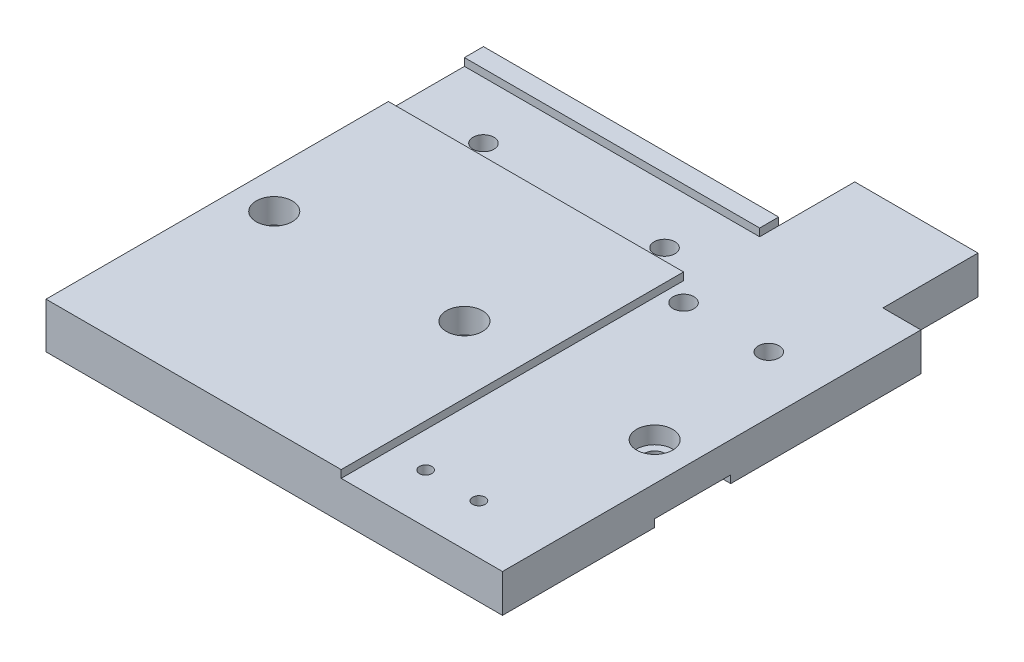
SolidWorks part; units mm, degrees
ref_plane "前视基准面" through (0, 0, 0) normal (0, 0, 1) x (1, 0, 0)
ref_plane "上视基准面" through (0, 0, 0) normal (0, 1, 0) x (1, 0, 0)
ref_plane "右视基准面" through (0, 0, 0) normal (1, 0, 0) x (0, 0, -1)
sketch "草图2" plane through (0, 0, 0) normal (0, 0, 1) x (1, 0, 0)
  line L0 (120, 0) -> (120, 10)
  line L1 (77.6, 10) -> (77.6, 12)
  line L2 (0, 0) -> (0, 12)
  line L3 (77.6, 10) -> (120, 10)
  line L4 (0, 0) -> (120, 0)
  line L5 (0, 12) -> (77.6, 12)
extrude "凸台-拉伸1" add sketch "草图2" along normal blind 135
sketch "草图3" plane through (0, 12, 0) normal (0, 1, 0) x (1, 0, 0)
  line L0 (0, -135) -> (120, -135)
  line L1 (77.6, 0) -> (110, 0)
  line L2 (120, -135) -> (120, -25)
  line L3 (0, -135) -> (0, -20)
  line L4 (77.6, -20) -> (77.6, 0)
  line L5 (0, -20) -> (77.6, -20)
  line L6 (110, -25) -> (120, -25)
  line L7 (110, -25) -> (110, 0)
  circle A0 centre (20, -40) radius 2.75
  circle A1 centre (67.6, -40) radius 2.75
  circle A2 centre (105, -50) radius 2.75
  circle A3 centre (82.6, -50) radius 2.75
  circle A4 centre (86.8, -122) radius 1.65
  circle A5 centre (100.8, -122) radius 1.65
  circle A6 centre (10, -85) radius 2.75
  circle A7 centre (60, -85) radius 2.75
  circle A8 centre (110, -85) radius 2.75
extrude "切除-拉伸1" cut sketch "草图3" against normal blind 135 flip side to cut
sketch "草图4" plane through (0, 12, 0) normal (0, 1, 0) x (1, 0, 0)
  circle A0 centre (10, -85) radius 4.75
  circle A1 centre (60, -85) radius 4.75
  circle A2 centre (110, -85) radius 4.75
extrude "切除-拉伸2" cut sketch "草图4" against normal blind 6.5
sketch "草图5" plane through (120, 0, 0) normal (1, 0, 0) x (0, 0, -1)
  line L0 (0, 0) -> (0, 10)
  line L1 (-135, 0) -> (-135, 12)
  line L2 (-135, 0) -> (-95, 0)
  line L4 (-135, 12) -> (-45, 12)
  line L5 (-20, 10) -> (-20, 12)
  line L7 (-25, 12) -> (-20, 12)
  line L8 (-95, 0) -> (-95, 2)
  line L9 (-75, 0) -> (-75, 2)
  line L10 (-95, 2) -> (-75, 2)
  line L11 (-75, 0) -> (0, 0)
  line L12 (-20, 10) -> (0, 10)
  line L13 (-25, 12) -> (-45, 12)
extrude "切除-拉伸3" cut sketch "草图5" against normal through all flip side to cut
sketch "草图7" plane through (0, 12, 0) normal (0, 1, 0) x (1, 0, 0)
  line L0 (0, -45) -> (77.6, -45)
  line L1 (0, -25) -> (77.6, -25)
  line L2 (0, -25) -> (0, -45)
  line L3 (77.6, -25) -> (77.6, -45)
extrude "切除-拉伸4" cut sketch "草图7" against normal up to surface (2 mm away)
